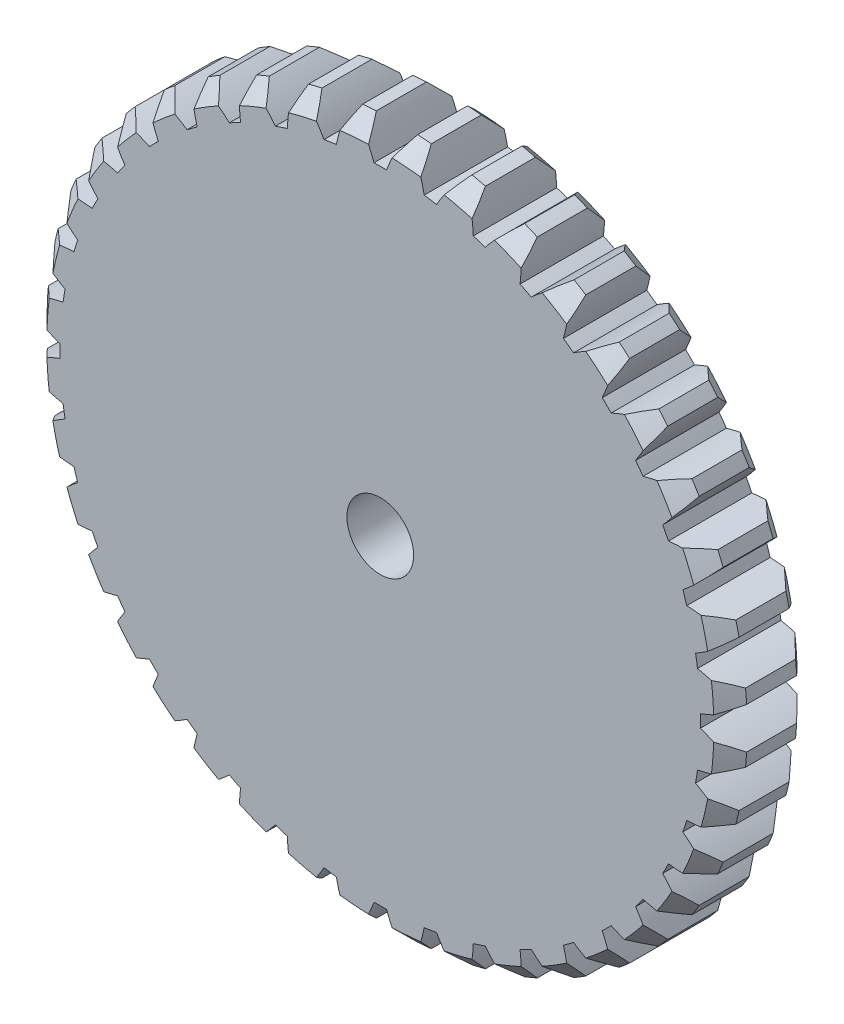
SolidWorks part; units mm, degrees
ref_plane "Plane1" through (0, 0, 0) normal (0, 0, 1) x (1, 0, 0)
ref_plane "Plane2" through (0, 0, 0) normal (0, 1, 0) x (-1, 0, 0)
ref_plane "Plane3" through (0, 0, 0) normal (1, 0, 0) x (0, 0, -1)
sketch "Sketch1" plane through (0, 0, 0) normal (0, 0, 1) x (1, 0, 0)
  circle A0 centre (0, 0) radius 21
  dimension "D1" = 42
extrude "Gear Blank" add sketch "Sketch1" along normal mid plane 5
chamfer "Front Gear Chamfer" distance 1 angle 45 1 edges at (21, 0, 2.5)
chamfer "Rear Gear Chamfer" distance 1 angle 45 1 edges at (21, 0, -2.5)
sketch "Sketch2" plane through (0, 0, 0) normal (0, 0, 1) x (1, 0, 0)
  line L0 (0, 21) -> (0, 0) construction
  line L1 (0, 0) -> (9.6524, 0) construction
  line L2 (0, 0) -> (-1.2363, 20.9636) construction
  line L3 (0, 0) -> (1.2363, 20.9636) construction
  line L4 (0, 0) -> (0.377, 19.1963) construction
  line L5 (0, 0) -> (-0.377, 19.1963) construction
  arc A1 (1.2363, 20.9636) -> (-1.2363, 20.9636) centre (0, 0) ccw
  arc A2 (1.2363, 20.9636) -> (0.377, 19.1963) centre (9.7563, 15.7282) ccw
  arc A3 (-1.2363, 20.9636) -> (-0.377, 19.1963) centre (-9.7563, 15.7282) cw
  arc A4 (-0.377, 19.1963) -> (0.377, 19.1963) centre (0, 0) cw
  circle A5 centre (0, 0) radius 21 construction
  dimension "D2" = 10
  dimension "D1" = 38.4
  dimension "D3" = 90
  dimension "D4" = 6.75
  dimension "D5" = 2.25
extrude "Tooth Cut" cut sketch "Sketch2" against normal mid plane 5
pattern_circular "Tooth Copies" count 40 every 9 about axis through (0, 0, 0) along (0, 0, 1) of "Tooth Cut"
sketch "Sketch4" plane through (0, 0, -2.5) normal (0, 0, -1) x (-1, 0, 0)
  circle A0 centre (0, 0) radius 2
  arc A1 (0.377, 19.1963) -> (-0.377, 19.1963) centre (0, 0) ccw construction
  dimension "D1" = 4
extrude "Extrude1" cut sketch "Sketch4" against normal through all
equation "\"D2@Tooth Copies\"=360/\"D1@Tooth Copies\""
equation "\"D4@Sketch2\" = (3/4) * \"D2@Tooth Copies\""
equation "\"D5@Sketch2\"= \"D2@Tooth Copies\" - \"D4@Sketch2\""
equation "\"D1@Sketch2\" = \"D1@Sketch1\" - 3.6"
equation "\"D1@Tooth Cut\" = \"D1@Gear Blank\""
